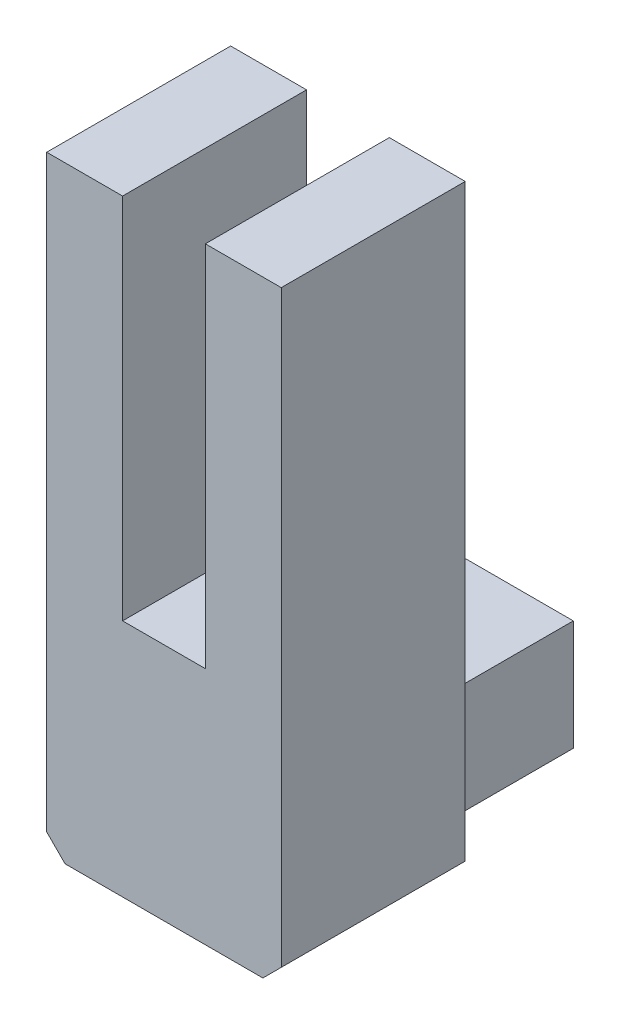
SolidWorks part; units mm, degrees
ref_plane "Plan de face" through (0, 0, 0) normal (0, 0, 1) x (1, 0, 0)
ref_plane "Plan de dessus" through (0, 0, 0) normal (0, 1, 0) x (1, 0, 0)
ref_plane "Plan de droite" through (0, 0, 0) normal (1, 0, 0) x (0, 0, -1)
sketch "Esquisse1" plane through (0, 0, 0) normal (0, 0, 1) x (1, 0, 0)
  line L0 (4.5, 0) -> (-4.5, 0)
  line L1 (-4.5, 0) -> (-4.5, 40)
  line L2 (-4.5, 40) -> (-12.75, 40)
  line L3 (-12.75, 40) -> (-12.75, -24)
  line L4 (-12.75, -24) -> (-10.75, -26)
  line L5 (-10.75, -26) -> (10.75, -26)
  line L6 (0, 40.9614) -> (0, -53.3334) construction
  line L11 (12.75, -24) -> (10.75, -26)
  line L12 (12.75, 40) -> (12.75, -24)
  line L13 (4.5, 40) -> (12.75, 40)
  line L14 (4.5, 0) -> (4.5, 40)
  point P21 (0, 0)
  dimension "D1" = 9
  dimension "D2" = 25.5
  dimension "D3" = 40
  dimension "D4" = 66
  dimension "D5" = 2
  dimension "D6" = 45
extrude "Extrusion1" add sketch "Esquisse1" along normal blind 20
sketch "Esquisse2" plane through (0, 0, 0) normal (0, 0, -1) x (-1, 0, 0)
  line L0 (10.75, -26) -> (-10.75, -26) construction
  line L1 (-6, -26) -> (6, -26)
  line L2 (-6, -26) -> (-6, -14)
  line L3 (-6, -14) -> (6, -14)
  line L4 (6, -26) -> (6, -14)
  dimension "D1" = 12
  dimension "D2" = 12
  dimension "D3" = 6
extrude "Extrusion2" add sketch "Esquisse2" along normal blind 18.5
